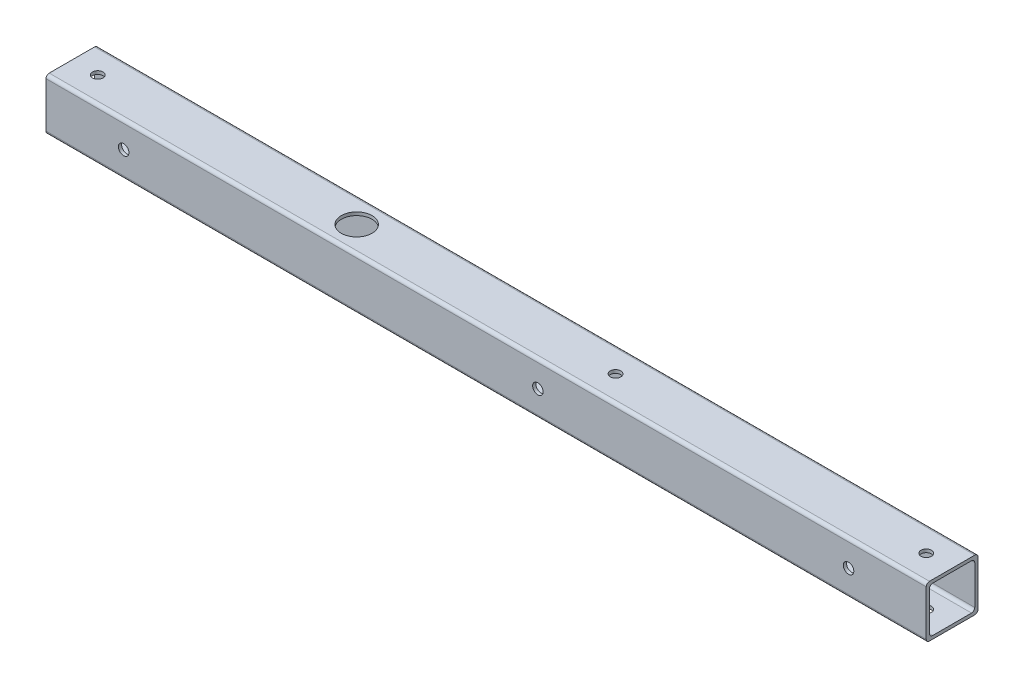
SolidWorks part; units mm, degrees
ref_plane "Front Plane" through (0, 0, 0) normal (0, 0, 1) x (1, 0, 0)
ref_plane "Top Plane" through (0, 0, 0) normal (0, 1, 0) x (1, 0, 0)
ref_plane "Right Plane" through (0, 0, 0) normal (1, 0, 0) x (0, 0, -1)
sketch "Sketch1" plane through (0, 0, 0) normal (0, 1, 0) x (1, 0, 0)
  line L1 (0, 0) -> (-1727.2, 0)
  line L2 (0, 0) -> (0, -101.6)
  line L3 (0, -101.6) -> (-1727.2, -101.6)
  line L4 (-1727.2, 0) -> (-1727.2, -101.6)
  dimension "D1" = 1727.2
  dimension "D2" = 101.6
extrude "Extrude1" add sketch "Sketch1" along normal blind 101.6
sketch "Sketch2" plane through (-1727.2, 0, 0) normal (-1, 0, 0) x (0, 0, 1)
  line L0 (0, 101.6) -> (101.6, 101.6) construction
  line L1 (6.35, 95.25) -> (95.25, 95.25)
  line L2 (6.35, 95.25) -> (6.35, 6.35)
  line L3 (6.35, 6.35) -> (95.25, 6.35)
  line L4 (95.25, 95.25) -> (95.25, 6.35)
  line L5 (0, 0) -> (101.6, 0) construction
  line L6 (101.6, 101.6) -> (101.6, 0) construction
  line L7 (0, 101.6) -> (0, 0) construction
  dimension "D1" = 6.35
  dimension "D2" = 6.35
  dimension "D3" = 6.35
  dimension "D4" = 6.35
extrude "Cut-Extrude1" cut sketch "Sketch2" against normal up to next
fillet "Fillet1" radius 6.35 8 edges at (-863.6, 6.35, 95.25) (-863.6, 0, 101.6) (-863.6, 101.6, 101.6) (-863.6, 95.25, 95.25) (-863.6, 95.25, 6.35) (-863.6, 101.6, 0) (-863.6, 6.35, 6.35) (-863.6, 0, 0)
sketch "Sketch3" plane through (0, 101.6, 0) normal (0, 1, 0) x (1, 0, 0)
  line L0 (0, -95.25) -> (0, -6.35) construction
  line L1 (0, -6.35) -> (-1727.2, -6.35) construction
  circle A0 centre (-1676.4, -50.8) radius 10.3188
  dimension "D1" = 20.6375
  dimension "D2" = 1676.4
  dimension "D3" = 44.45
extrude "Cut-Extrude2" cut sketch "Sketch3" against normal blind 101.6
sketch "Sketch4" plane through (0, 101.6, 0) normal (0, 1, 0) x (1, 0, 0)
  line L0 (0, -95.25) -> (0, -6.35) construction
  line L1 (0, -6.35) -> (-1727.2, -6.35) construction
  circle A0 centre (-50.8, -50.8) radius 10.3188
  dimension "D1" = 20.6375
  dimension "D2" = 50.8
  dimension "D3" = 44.45
extrude "Cut-Extrude3" cut sketch "Sketch4" against normal blind 101.6
sketch "Sketch5" plane through (0, 101.6, 0) normal (0, 1, 0) x (1, 0, 0)
  line L0 (0, -95.25) -> (0, -6.35) construction
  line L1 (0, -6.35) -> (-1727.2, -6.35) construction
  circle A0 centre (-1168.4, -50.8) radius 30.1625
  dimension "D1" = 60.325
  dimension "D2" = 1168.4
  dimension "D3" = 44.45
extrude "Cut-Extrude4" cut sketch "Sketch5" against normal blind 101.6
sketch "Sketch6" plane through (0, 0, 0) normal (0, 0, -1) x (-1, 0, 0)
  line L0 (0, 95.25) -> (0, 6.35) construction
  line L1 (1727.2, 95.25) -> (0, 95.25) construction
  circle A0 centre (1574.8, 50.8) radius 10.3188
  dimension "D1" = 20.6375
  dimension "D2" = 1574.8
  dimension "D3" = 44.45
extrude "Cut-Extrude5" cut sketch "Sketch6" against normal blind 101.6
sketch "Sketch7" plane through (0, 0, 0) normal (0, 0, -1) x (-1, 0, 0)
  line L0 (0, 95.25) -> (0, 6.35) construction
  line L1 (1727.2, 95.25) -> (0, 95.25) construction
  circle A0 centre (152.4, 50.8) radius 10.3187
  dimension "D1" = 20.6375
  dimension "D2" = 152.4
  dimension "D3" = 44.45
extrude "Cut-Extrude6" cut sketch "Sketch7" against normal blind 101.6
sketch "Sketch8" plane through (0, 0, 0) normal (0, 0, -1) x (-1, 0, 0)
  line L0 (0, 95.25) -> (0, 6.35) construction
  line L1 (1727.2, 95.25) -> (0, 95.25) construction
  circle A0 centre (762, 50.8) radius 10.3187
  dimension "D1" = 20.6375
  dimension "D2" = 762
  dimension "D3" = 44.45
extrude "Cut-Extrude7" cut sketch "Sketch8" against normal blind 101.6
sketch "Sketch9" plane through (0, 101.6, 0) normal (0, 1, 0) x (1, 0, 0)
  line L0 (-1727.2, -6.35) -> (-1727.2, -95.25) construction
  line L1 (0, -6.35) -> (-1727.2, -6.35) construction
  circle A0 centre (-660.4, -50.8) radius 10.3188
  dimension "D1" = 20.6375
  dimension "D2" = 1066.8
  dimension "D3" = 44.45
extrude "Cut-Extrude8" cut sketch "Sketch9" against normal blind 101.6
